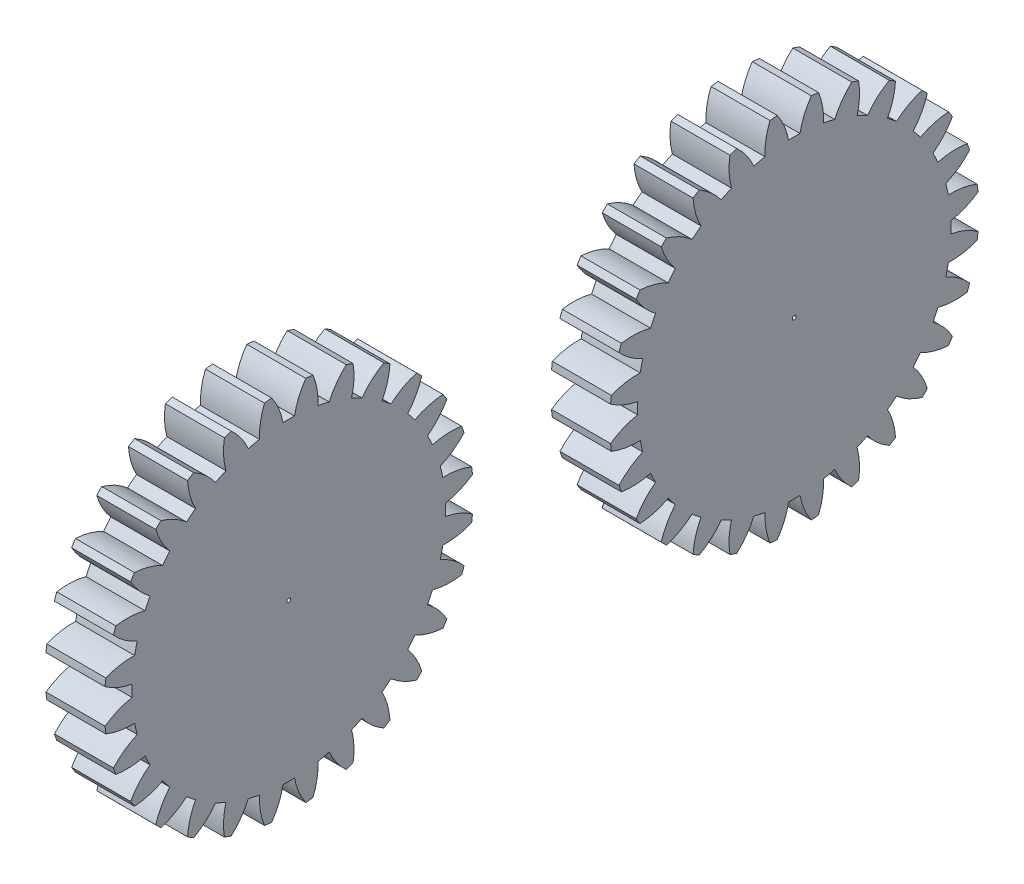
SolidWorks part; units mm, degrees
other "<spur gear_am>-<Bore>"
other "<spur gear_am>-<Bore>"
ref_plane "Front Plane" through (0, 0, 0) normal (0, 0, 1) x (1, 0, 0)
ref_plane "Top Plane" through (0, 0, 0) normal (0, 1, 0) x (1, 0, 0)
ref_plane "Right Plane" through (0, 0, 0) normal (1, 0, 0) x (0, 0, -1)
sketch "Sketch1" plane through (0, 0, 0) normal (0, 0, 1) x (1, 0, 0)
  line L0 (0, 0) -> (5.5204, 9.5617) construction
  line L1 (0, 0) -> (-7.7529, 0) construction
  line L2 (0, 0) -> (4.7704, -8.2626) construction
  line L9 (0, 0) -> (0, 11.6168) construction
  circle A2 centre (2.5, 4.3301) radius 1.5
  circle A3 centre (2.5, -4.3301) radius 1.5
  circle A4 centre (-5, 0) radius 1.5
  circle A5 centre (0, 0) radius 5 construction
  circle A6 centre (0, 0) radius 10
  dimension "D1" = 20
  dimension "D5" = 3
  dimension "D6" = 10
  dimension "D3" = 120
  dimension "D4" = 120
ref_plane "Plane1" through (0, 4, 0) normal (0, 1, 0) x (1, 0, 0)
inserted part "spur gear_am"
inserted part "spur gear_am1"
